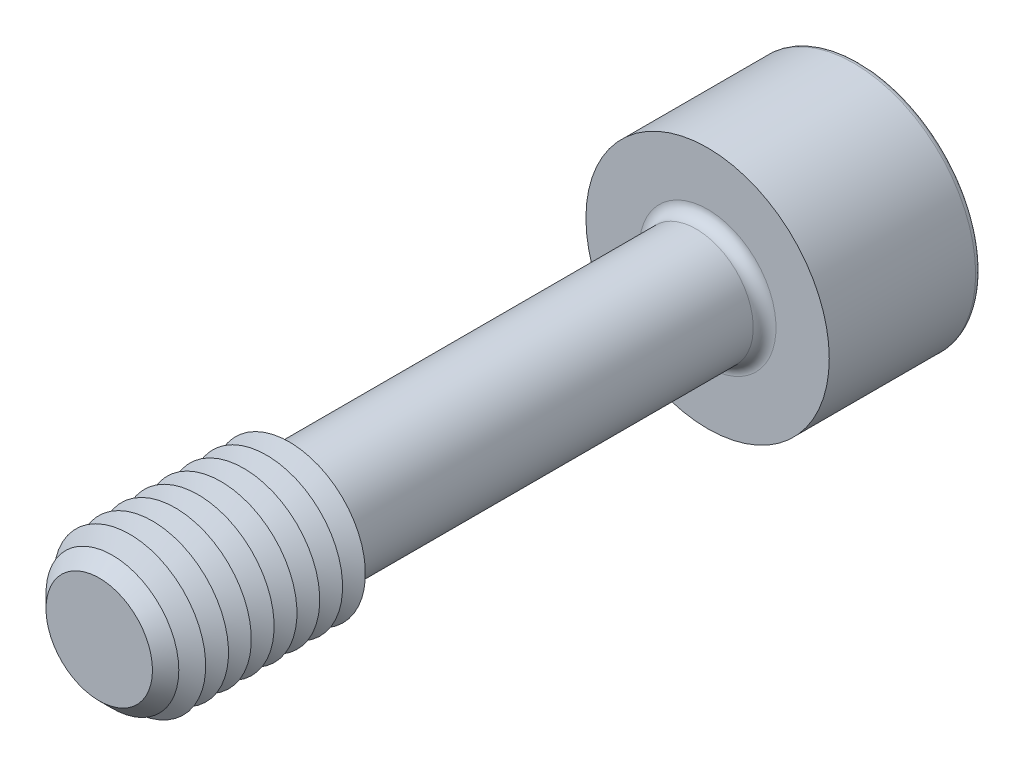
SolidWorks part; units mm, degrees
ref_plane "Front Plane" through (0, 0, 0) normal (0, 0, 1) x (1, 0, 0)
ref_plane "Top Plane" through (0, 0, 0) normal (0, 1, 0) x (1, 0, 0)
ref_plane "Right Plane" through (0, 0, 0) normal (1, 0, 0) x (0, 0, -1)
sketch "Sketch1" plane through (0, 0, 0) normal (0, 0, 1) x (1, 0, 0)
  circle A0 centre (0, 0) radius 3.75
  dimension "D1" = 7.5
extrude "Extrude1" add sketch "Sketch1" along normal mid plane 40
sketch "Sketch2" plane through (0, 0, 0) normal (1, 0, 0) x (0, 0, -1)
  line L0 (-20, 0) -> (-20, 5)
  line L1 (-20, 3.75) -> (-20, -3.75) construction
  line L2 (-20, 5) -> (-7.5, 5)
  line L3 (-7.5, 5) -> (-6.7783, 3.75)
  line L4 (20, 3.75) -> (-20, 3.75) construction
  line L5 (-6.7783, 3.75) -> (-6.7783, 0)
  line L6 (-6.7783, 0) -> (-20, 0)
  dimension "D1" = 5
  dimension "D2" = 120
  dimension "D3" = 12.5
revolve "Revolve1" add sketch "Sketch2" angle 360 about L6
chamfer "Chamfer1" distance 1.5 angle 45 1 edges at (0, 5, 20)
sketch "Sketch3" plane through (0, 0, -20) normal (0, 0, -1) x (-1, 0, 0)
  circle A0 centre (0, 0) radius 8
  dimension "D1" = 16
extrude "Extrude2" add sketch "Sketch3" along normal blind 10
sketch "Sketch4" plane through (-13.7, 0, -30) normal (0, 0, 1) x (1, 0, 0)
  line L2 (11.3906, -4) -> (16.0094, -4)
  line L3 (16.0094, -4) -> (18.3188, 0)
  line L4 (18.3188, 0) -> (16.0094, 4)
  line L6 (16.0094, 4) -> (11.3906, 4)
  line L7 (11.3906, 4) -> (9.0812, 0)
  line L8 (9.0812, 0) -> (11.3906, -4)
  circle A0 centre (13.7, 0) radius 4 construction
  dimension "D1" = 8
extrude "Extrude3" cut sketch "Sketch4" along normal blind 8
fillet "Fillet1" radius 0.75 1 edges at (-3.75, 0, -20)
fillet "Fillet2" radius 0.375 1 edges at (-8, 0, -30)
sketch "Sketch5" plane through (0, 0, 0) normal (1, 0, 0) x (0, 0, -1)
  line L0 (22, 0) -> (22, -4)
  line L1 (22, -4) -> (19.6906, 0)
  line L2 (19.6906, 0) -> (22, 0)
  dimension "D1" = 30
revolve "Cut-Revolve1" cut sketch "Sketch5" angle 360 about L2
sketch "Sketch6" plane through (0, 0, 0) normal (1, 0, 0) x (0, 0, -1)
  line L0 (1.332, 0) -> (-13.289, 0) construction
sketch "Sketch7" plane through (0, 0, 0) normal (1, 0, 0) x (0, 0, -1)
  line L0 (-7.5, 5) -> (-8.25, 3.701)
  line L1 (-8.25, 3.701) -> (-9, 5)
  line L2 (-7.5, 5) -> (-18.5, 5) construction
  line L3 (-9, 5) -> (-7.5, 5)
  dimension "D1" = 1.5
revolve "Cut-Revolve2" cut sketch "Sketch7" angle 360 about L0
pattern_linear "LPattern1" count 8 spacing 1.5 along (0, 0, 1) of "Cut-Revolve2"
